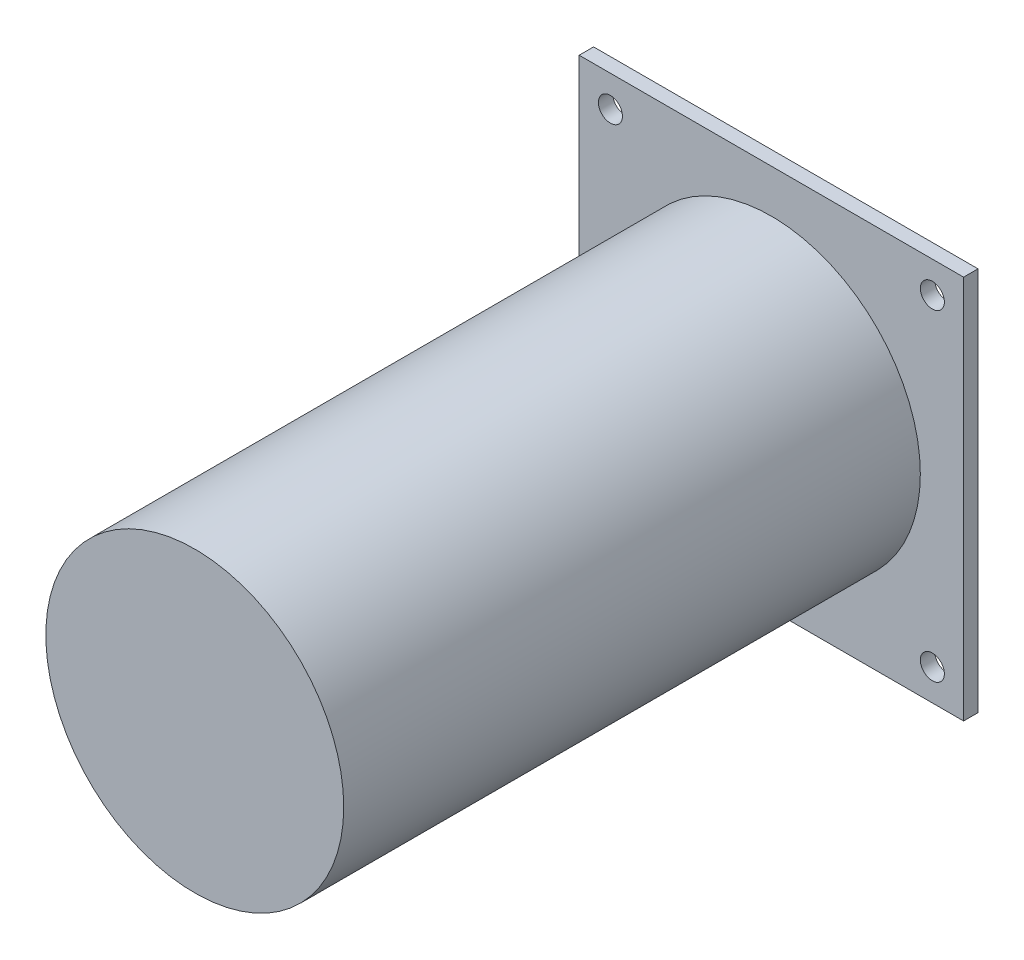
SolidWorks part; units mm, degrees
ref_plane "Piano frontale" through (0, 0, 0) normal (0, 0, 1) x (1, 0, 0)
ref_plane "Piano superiore" through (0, 0, 0) normal (0, 1, 0) x (1, 0, 0)
ref_plane "Piano destro" through (0, 0, 0) normal (1, 0, 0) x (0, 0, -1)
sketch "Schizzo1" plane through (0, 0, 0) normal (0, 0, 1) x (1, 0, 0)
  circle A0 centre (0, 0) radius 31
  dimension "D1" = 62
extrude "Estrusione-Estrusione1" add sketch "Schizzo1" along normal blind 120
sketch "Schizzo2" plane through (0, 0, 0) normal (0, 0, -1) x (-1, 0, 0)
  line L1 (-40, -40) -> (40, -40)
  line L2 (-40, -40) -> (-40, 40)
  line L3 (-40, 40) -> (40, 40)
  line L4 (40, -40) -> (40, 40)
  line L5 (-40, -40) -> (40, 40) construction
  line L6 (-40, 40) -> (40, -40) construction
  point P0 (0, 0)
  dimension "D1" = 80
  dimension "D2" = 80
extrude "Estrusione-Estrusione2" add sketch "Schizzo2" along normal blind 3
sketch "Schizzo3" plane through (0, 0, -3) normal (0, 0, -1) x (-1, 0, 0)
  circle A0 centre (0, 0) radius 6
  dimension "D1" = 12
extrude "Estrusione-Estrusione3" add sketch "Schizzo3" along normal blind 9
sketch "Schizzo4" plane through (0, 0, -12) normal (0, 0, -1) x (-1, 0, 0)
  circle A0 centre (0, 0) radius 18
  dimension "D1" = 36
extrude "Estrusione-Estrusione4" add sketch "Schizzo4" along normal blind 10
ref_plane "Piano3" through (0, 0, 0) normal (1, 0, 0) x (0, 0, -1)
sketch "Schizzo6" plane through (0, 0, 0) normal (1, 0, 0) x (0, 0, -1)
  line L6 (22, 18) -> (12, 18) construction
  line L7 (0, 0) -> (31.7081, 0)
  line L9 (14.5, 22) -> (19.5, 22)
  line L14 (14.5, 22) -> (14.5, 14)
  line L15 (14.5, 14) -> (19.5, 14)
  line L16 (19.5, 22) -> (19.5, 14)
  line L17 (14.5, 22) -> (19.5, 14) construction
  line L18 (14.5, 14) -> (19.5, 22) construction
  point P0 (17, 18)
  dimension "D1" = 5
  dimension "D2" = 8
revolve "Taglia-Rivoluzione5" cut sketch "Schizzo6" angle 360 about L7
fillet "Raccordo1" radius 1.5 2 edges at (14, 0, -19.5) (14, 0, -14.5)
sketch "Schizzo8" plane through (0, 0, -3) normal (0, 0, -1) x (-1, 0, 0)
  line L1 (-33.5, 33.5) -> (33.5, 33.5) construction
  line L2 (-33.5, 33.5) -> (-33.5, -33.5) construction
  line L3 (-33.5, -33.5) -> (33.5, -33.5) construction
  line L4 (33.5, 33.5) -> (33.5, -33.5) construction
  line L5 (-33.5, 33.5) -> (33.5, -33.5) construction
  line L6 (-33.5, -33.5) -> (33.5, 33.5) construction
  point P0 (0, 0)
  dimension "D1" = 67
  dimension "D2" = 67
hole_wizard "Foro filettato M6-1" positions "Schizzo11" profile "Schizzo12" tap size "M6" standard "ISO"
sketch "Schizzo11" plane through (0, 0, -3) normal (0, 0, -1) x (-1, 0, 0)
  point P0 (-33.5, 33.5)
  point P3 (-33.5, -33.5)
  point P6 (33.5, -33.5)
  point P9 (33.5, 33.5)
sketch "Schizzo12" plane through (33.5, 33.5, -3) normal (1, 0, 0) x (0, 1, 0)
  line L0 (0, 0) -> (0, 123)
  line L1 (0, 123) -> (2.5, 123)
  line L2 (2.5, 123) -> (2.5, 0)
  line L5 (2.5, 0) -> (0, 0)
  line L11 (0, -6.35) -> (0, 107.95) construction
  dimension "Thru Tap Drill Dia." = 5
  dimension "Thru Tap Drill Depth" = 123
